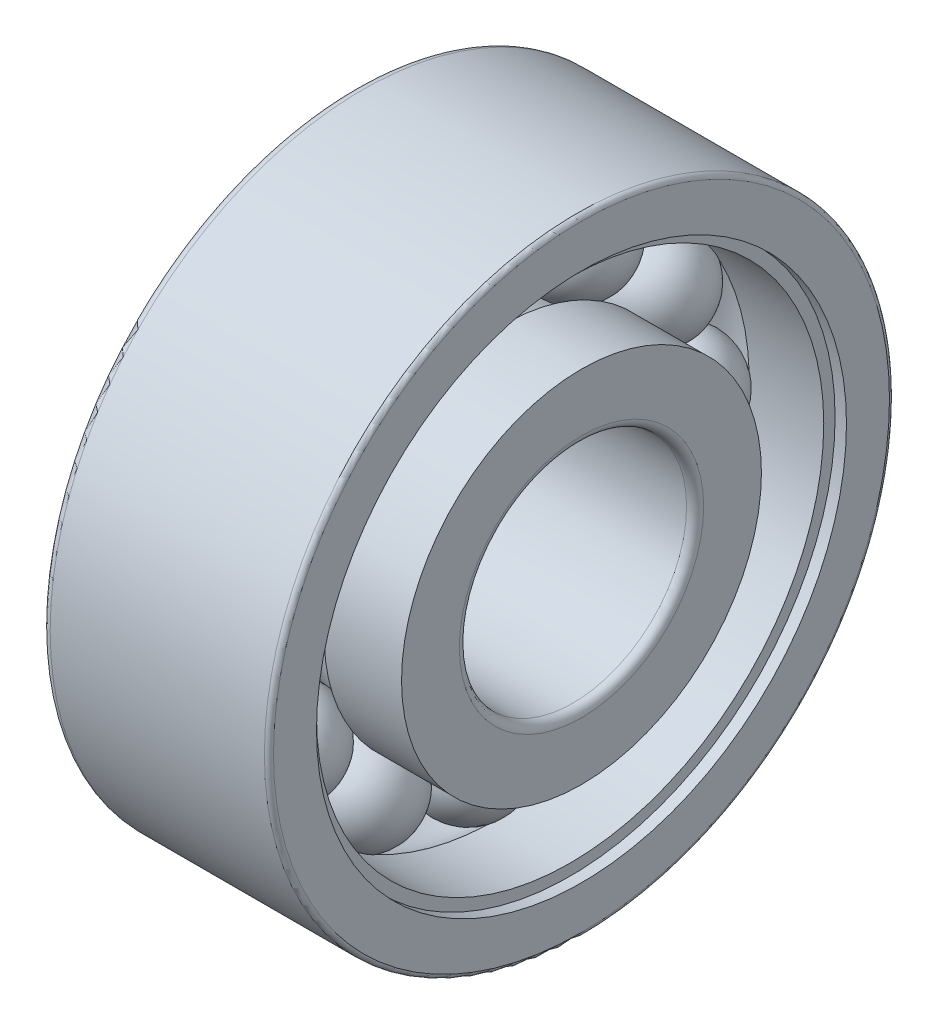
SolidWorks part; units mm, degrees
ref_plane "Front" through (0, 0, 0) normal (0, 0, 1) x (1, 0, 0)
ref_plane "Top" through (0, 0, 0) normal (0, 1, 0) x (1, 0, 0)
ref_plane "Right" through (0, 0, 0) normal (1, 0, 0) x (0, 0, -1)
sketch "Sketch1" plane through (0, 0, 0) normal (0, 0, 1) x (1, 0, 0)
  line L0 (-3.0919, 0) -> (2.899, 0) construction
  line L1 (-3.0919, 3.75) -> (2.899, 3.75) construction
  line L2 (-0.875, 3.75) -> (0.875, 3.75)
  arc A0 (-0.875, 3.75) -> (0.875, 3.75) centre (0, 3.75) ccw
  dimension "R" = 0.875
  dimension "D1" = 3.75
revolve "Revolve1" add sketch "Sketch1" angle 360 about L1
sketch "Sketch2" plane through (0, 0, 0) normal (0, 0, 1) x (1, 0, 0)
  line L0 (-2, 3.1667) -> (-0.6387, 3.1667)
  line L1 (2, 3.1667) -> (2, 2)
  line L2 (2, 2) -> (-2, 2)
  line L3 (-2, 2) -> (-2, 3.1667)
  line L4 (-2.9924, 0) -> (3.9982, 0) construction
  line L5 (-1.8743, 3.75) -> (3.1755, 3.75) construction
  line L7 (0.6387, 3.1667) -> (2, 3.1667)
  line L8 (-2, 6.2861) -> (-2, 1.454) construction
  arc A0 (-0.6387, 3.1667) -> (0.6387, 3.1667) centre (0, 3.75) ccw
  dimension "D2" = 0.865
  dimension "D1" = 3.75
  dimension "d" = 4
  dimension "D3" = 6.3333
  dimension "T" = 4
  dimension "D6" = 2
  dimension "B" = 4
revolve "Revolve2" add sketch "Sketch2" angle 360 about L4
sketch "Sketch3" plane through (0, 0, 0) normal (0, 0, 1) x (1, 0, 0)
  line L0 (-2, 4.3333) -> (-2, 5.5)
  line L1 (-2, 5.5) -> (2, 5.5)
  line L2 (2, 5.5) -> (2, 4.6633)
  line L3 (1.8, 4.4633) -> (0.4893, 4.4633)
  line L4 (-2.9924, 0) -> (3.4329, 0) construction
  line L6 (-1.7375, 3.75) -> (2.2712, 3.75) construction
  line L7 (-0.6387, 4.3333) -> (-2, 4.3333)
  line L8 (1.8, 4.4633) -> (1.8, 4.6633)
  line L9 (1.8, 4.6633) -> (2, 4.6633)
  arc A0 (0.4893, 4.4633) -> (-0.6387, 4.3333) centre (0, 3.75) ccw
  dimension "D4" = 0.865
  dimension "D1" = 3.75
  dimension "D2" = 2
  dimension "B" = 4
  dimension "D3" = 8.9267
  dimension "DD" = 11
  dimension "D5" = 8.6667
  dimension "D6" = 0.2
  dimension "D7" = 0.2
revolve "Revolve3" add sketch "Sketch3" angle 360 about L4
pattern_circular "Circular-Pattern1" count 12 over 360 about axis through (0, 0, 0) along (1, 0, 0) of "Revolve1"
fillet "Fillet1" radius 0.15 2 edges at (2, 0, 2) (-2, 0, 5.5)
fillet "Fillet2" radius 0.08 2 edges at (2, 0, 5.5) (-2, 0, 2)
equation "\"R@Sketch1\" =  ( \"DD@Sketch3\" - \"d@Sketch2\" )  / 8"
equation "\"D1@Sketch1\"=(\"d@Sketch2\"+\"DD@Sketch3\")/4"
equation "\"D1@Sketch2\"=(\"d@Sketch2\"+\"DD@Sketch3\")/4"
equation "\"D3@Sketch2\" =  \"d@Sketch2\"+  ( \"DD@Sketch3\" - \"d@Sketch2\" )  /3"
equation "\"D2@Sketch2\" =  ( \"DD@Sketch3\" - \"d@Sketch2\" )  / 8 - 0.01"
equation "\"D6@Sketch2\" = \"B@Sketch2\" / 2"
equation "\"B@Sketch3\" = \"B@Sketch2\""
equation "\"D2@Sketch3\" = \"B@Sketch3\" / 2"
equation "\"D1@Sketch3\"=(\"d@Sketch2\"+\"DD@Sketch3\")/4"
equation "\"D3@Sketch3\" = (  \"DD@Sketch3\" -  (\"DD@Sketch3\" - \"d@Sketch2\"  )  / 3 )  * 1.03"
equation "\"D5@Sketch3\" = \"DD@Sketch3\" -  (  \"DD@Sketch3\" - \"d@Sketch2\")  / 3"
equation "\"D6@Sketch3\" = \"d@Sketch2\" / 20"
equation "\"D7@Sketch3\"=\"D6@Sketch3\""
equation "\"D4@Sketch3\"=(\"DD@Sketch3\"-\"d@Sketch2\")/8-0.01"
equation "\"m@Circular-Pattern1\" = int( 3.14159265 / atn(\"R@Sketch1\" / sqr((\"d@Sketch2\"+\"DD@Sketch3\")/4 * (\"d@Sketch2\"+\"DD@Sketch3\")/4 - \"R@Sketch1\" *  \"R@Sketch1\")))-1"
